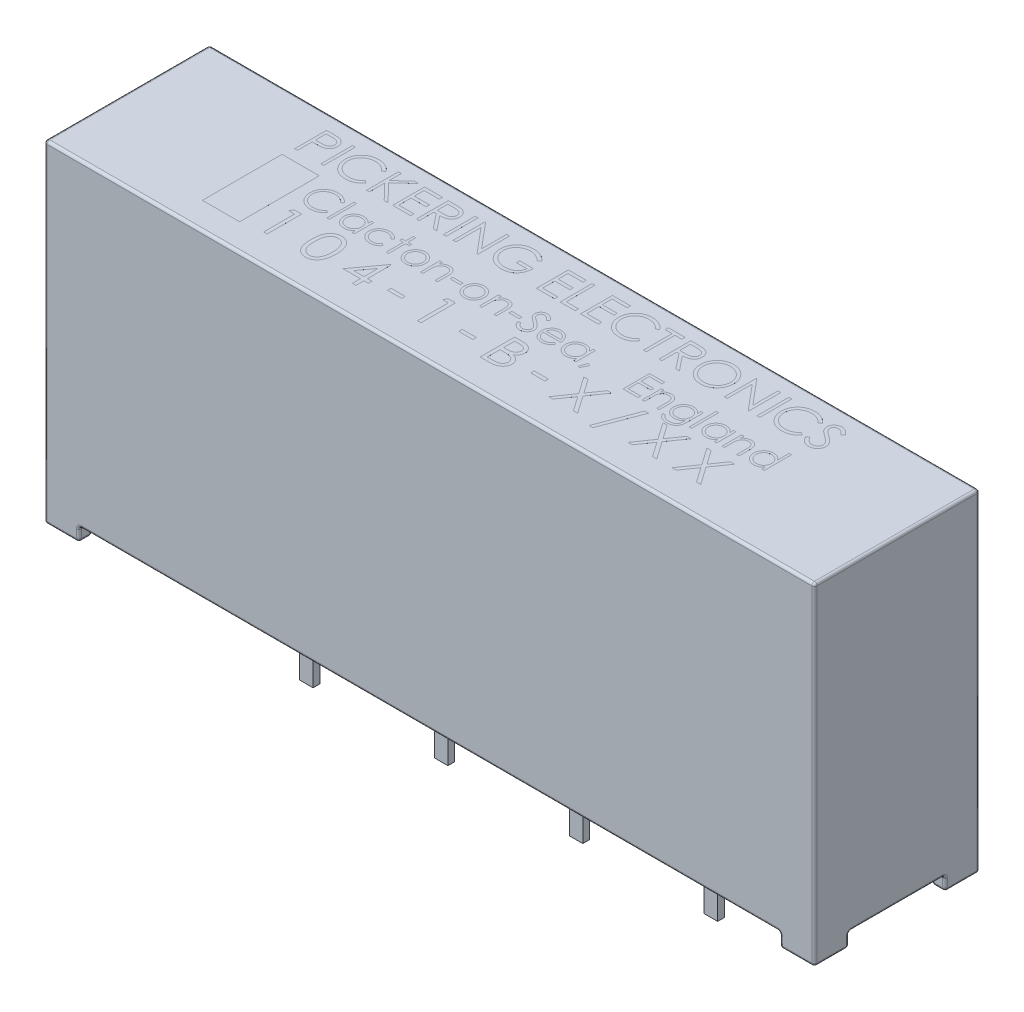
SolidWorks part; units mm, degrees
ref_plane "Front Plane" through (0, 0, 0) normal (0, 0, 1) x (1, 0, 0)
ref_plane "Top Plane" through (0, 0, 0) normal (0, 1, 0) x (1, 0, 0)
ref_plane "Right Plane" through (0, 0, 0) normal (1, 0, 0) x (0, 0, -1)
sketch "Sketch1" plane through (0, 0, 0) normal (0, 1, 0) x (1, 0, 0)
  line L1 (14.5, -3.11) -> (-14.5, -3.11)
  line L2 (14.5, -3.11) -> (14.5, 3.11)
  line L3 (14.5, 3.11) -> (-14.5, 3.11)
  line L4 (-14.5, -3.11) -> (-14.5, 3.11)
  line L5 (14.5, -3.11) -> (-14.5, 3.11) construction
  line L6 (14.5, 3.11) -> (-14.5, -3.11) construction
  point P0 (0, 0)
  dimension "D1" = 6.22
  dimension "D2" = 29
extrude "Main Body" add sketch "Sketch1" along normal blind 11.992
sketch "Sketch2" plane through (0, 0, 0) normal (0, -1, 0) x (1, 0, 0)
  line L1 (-14.5, 3.11) -> (-13.2, 3.11)
  line L2 (-14.5, 3.11) -> (-14.5, 1.81)
  line L3 (-14.5, 1.81) -> (-14, 1.81)
  line L4 (-13.2, 3.11) -> (-13.2, 2.61)
  line L7 (-13.2, 2.61) -> (-14, 2.61)
  line L8 (-14, 1.81) -> (-14, 2.61)
  dimension "D1" = 1.3
  dimension "D2" = 1.3
  dimension "D3" = 0.5
  dimension "D4" = 0.5
extrude "Original foot" add sketch "Sketch2" along normal blind 0.508
mirror "Left foot" about plane through (0, 0, 0) normal (0, 0, 1) of "Original foot"
mirror "Right Feet" about plane through (0, 0, 0) normal (1, 0, 0) of "Left foot", "Original foot"
sketch "Sketch3" plane through (0, 0, 0) normal (0, -1, 0) x (1, 0, 0)
  line L1 (-14.5, -1.81) -> (-14.5, 1.81) construction
  line L7 (-2.794, -0.127) -> (-2.286, -0.127)
  line L8 (-2.794, -0.127) -> (-2.794, 0.127)
  line L9 (-2.794, 0.127) -> (-2.286, 0.127)
  line L10 (-2.286, -0.127) -> (-2.286, 0.127)
  line L11 (-2.794, -0.127) -> (-2.286, 0.127) construction
  line L12 (-2.794, 0.127) -> (-2.286, -0.127) construction
  line L19 (2.286, -0.127) -> (2.794, -0.127)
  line L20 (2.286, -0.127) -> (2.286, 0.127)
  line L21 (2.286, 0.127) -> (2.794, 0.127)
  line L22 (2.794, -0.127) -> (2.794, 0.127)
  line L23 (2.286, -0.127) -> (2.794, 0.127) construction
  line L24 (2.286, 0.127) -> (2.794, -0.127) construction
  line L27 (7.366, -0.127) -> (7.874, -0.127)
  line L28 (7.366, -0.127) -> (7.366, 0.127)
  line L29 (7.366, 0.127) -> (7.874, 0.127)
  line L30 (7.874, -0.127) -> (7.874, 0.127)
  line L31 (7.366, -0.127) -> (7.874, 0.127) construction
  line L32 (7.366, 0.127) -> (7.874, -0.127) construction
  line L33 (-7.366, -0.127) -> (-7.874, -0.127)
  line L34 (-7.366, -0.127) -> (-7.366, 0.127)
  line L35 (-7.366, 0.127) -> (-7.874, 0.127)
  line L36 (-7.874, -0.127) -> (-7.874, 0.127)
  line L37 (-7.366, -0.127) -> (-7.874, 0.127) construction
  line L38 (-7.366, 0.127) -> (-7.874, -0.127) construction
  point P5 (-2.54, 0)
  point P15 (2.54, 0)
  point P20 (7.62, 0)
  point P26 (-7.62, 0)
  dimension "D2" = 6.88
  dimension "D3" = 0.508
  dimension "D4" = 0.254
  dimension "D5" = 0.508
  dimension "D6" = 0.254
  dimension "D10" = 5.08
  dimension "D12" = 0.508
  dimension "D13" = 0.254
  dimension "D14" = 5.08
  dimension "D15" = 0.254
  dimension "D16" = 0.508
  dimension "D17" = 5.08
extrude "Pins" add sketch "Sketch3" along normal blind 3.808
sketch "Sketch4"
  dimension "D1" = 19.3
  dimension "D2" = 17.5
  dimension "D3" = 17.5
  dimension "D4" = 1.8
  dimension "D5" = 1.65
  dimension "D6" = 1.65
  dimension "D7" = 4.85
  dimension "D8" = 3
  dimension "D9" = 1.4
  dimension "D10" = 4.95
  dimension "D11" = 1
extrude "Lettering" add sketch "Sketch4" along normal blind 0.0001
fillet "Fillet1" radius 0.1 72 edges at (14, -0.254, -1.81) (14.5, -0.254, -1.81) (14.5, -0.254, 1.81) (14, -0.254, 1.81) (13.6, 0, -2.61) (14.25, 0, -1.81) (14.25, 0, 1.81) (13.6, 0, 2.61) (-13.6, 0, 2.61) (-13.6, 0, -2.61) (-13.6, -0.508, -2.61) (-13.85, -0.508, -3.11) (-14.5, -0.508, -2.46) (13.2, -0.254, -2.61) (13.2, -0.254, -3.11) (13.2, 0, -2.86) (14, -0.254, -2.61) (14, 0, -2.21) (14, -0.254, 2.61) (14, 0, 2.21) (13.2, -0.254, 2.61) (13.2, -0.254, 3.11) (13.2, 0, 2.86) (-14, -0.254, 1.81) (-14, -0.254, 2.61) (-14, 0, 2.21) (-13.2, -0.254, 2.61) (-14.25, -0.508, -1.81) (-14.5, -0.254, -1.81) (-14, -0.254, -1.81) (-14.25, 0, -1.81) (-14, -0.254, -2.61) (-14, -0.508, -2.21) (-14, 0, -2.21) (-13.2, -0.254, -2.61) (-13.2, -0.254, -3.11) (-13.2, -0.508, -2.86) (-13.2, 0, -2.86) (-13.85, -0.508, 3.11) (-13.2, -0.508, 2.86) (-13.6, -0.508, 2.61) (-14, -0.508, 2.21) (-14.25, -0.508, 1.81) (-14.5, -0.508, 2.46) (13.85, -0.508, -3.11) (13.2, -0.508, -2.86) (13.6, -0.508, -2.61) (14, -0.508, -2.21) (14.25, -0.508, -1.81) (14.5, -0.508, -2.46) (14.25, -0.508, 1.81) (14, -0.508, 2.21) (13.6, -0.508, 2.61) (13.2, -0.508, 2.86) (13.85, -0.508, 3.11) (14.5, -0.508, 2.46) (14.5, 0, 0) (0, 0, -3.11) (0, 11.992, -3.11) (14.5, 5.742, -3.11) (14.5, 11.992, 0) (14.5, 5.742, 3.11) (0, 11.992, 3.11) (-14.5, 11.992, 0) (-14.5, 5.742, -3.11) (-14.5, 5.742, 3.11)
